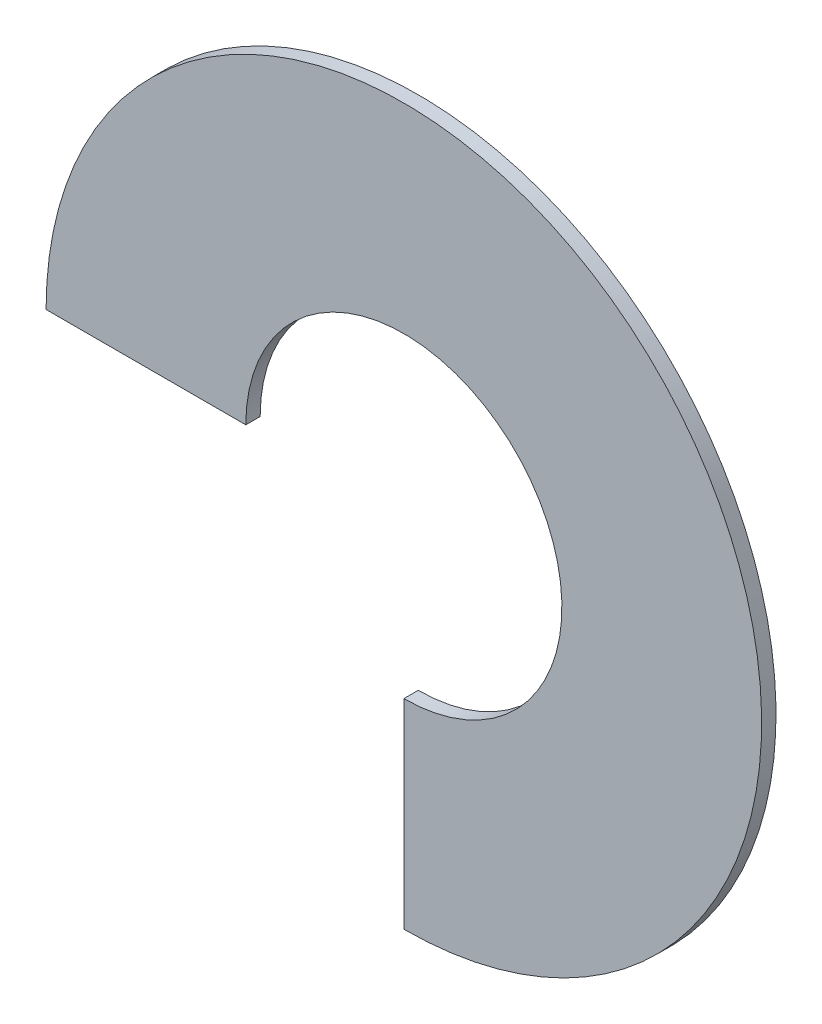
SolidWorks part; units mm, degrees
ref_plane "Plan de face" through (0, 0, 0) normal (0, 0, 1) x (1, 0, 0)
ref_plane "Plan de dessus" through (0, 0, 0) normal (0, 1, 0) x (1, 0, 0)
ref_plane "Plan de droite" through (0, 0, 0) normal (1, 0, 0) x (0, 0, -1)
sketch "Esquisse1" plane through (0, 0, 0) normal (0, 0, 1) x (1, 0, 0)
  circle A0 centre (0, 0) radius 12.45
  circle A1 centre (0, 0) radius 5.5
  dimension "D1" = 24.9
  dimension "D2" = 11
extrude "Extrusion1" add sketch "Esquisse1" along normal blind 0.5
sketch "Esquisse2" plane through (0, 0, 0) normal (1, 0, 0) x (0, 0, -1)
  line L1 (-9.3698, 0) -> (8.2549, 0)
  line L2 (-9.3698, 0) -> (-9.3698, -21.319)
  line L3 (-9.3698, -21.319) -> (8.2549, -21.319)
  line L4 (8.2549, 0) -> (8.2549, -21.319)
extrude "Enlèv. mat.-Extru.1" cut sketch "Esquisse2" against normal through all
